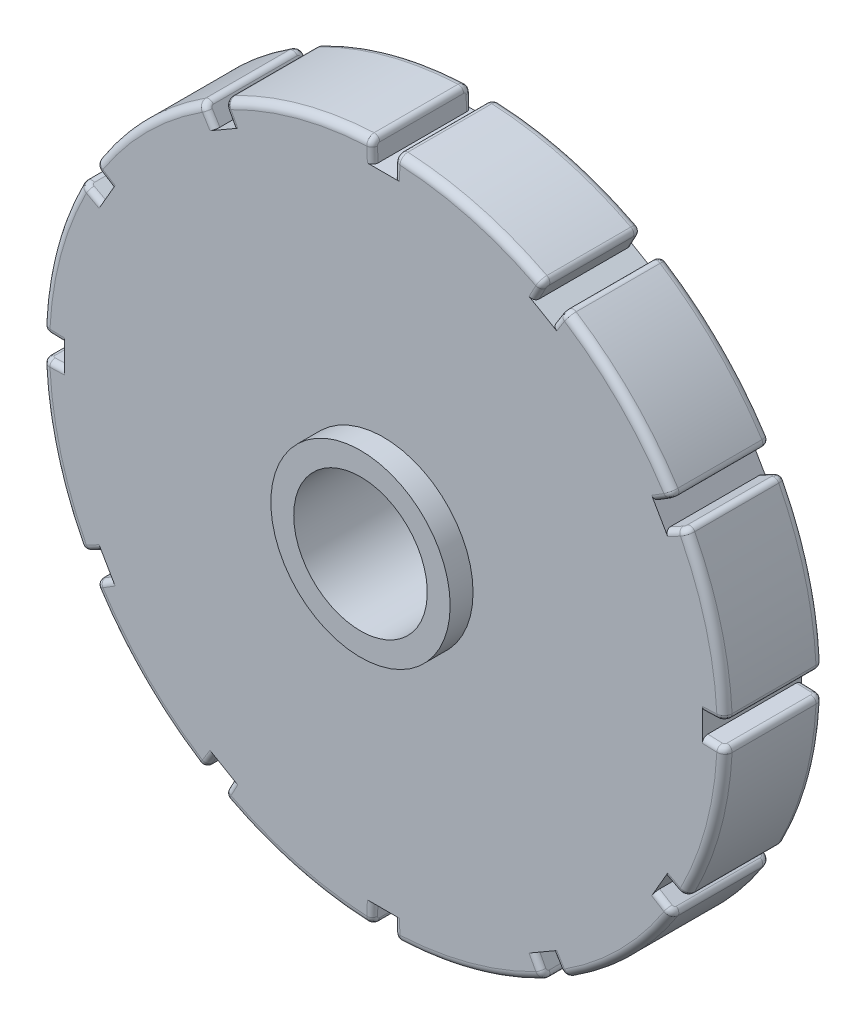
SolidWorks part; units mm, degrees
ref_plane "Face" through (0, 0, 0) normal (0, 0, 1) x (1, 0, 0)
ref_plane "Dessus" through (0, 0, 0) normal (0, 1, 0) x (1, 0, 0)
ref_plane "Droite" through (0, 0, 0) normal (1, 0, 0) x (0, 0, -1)
sketch "Esquisse1" plane through (0, 0, 0) normal (0, 0, 1) x (1, 0, 0)
  circle A0 centre (0, 0) radius 44.75
  circle A1 centre (0, 0) radius 8.75
  dimension "D1" = 89.5
  dimension "D2" = 17.5
extrude "Extrusion1" add sketch "Esquisse1" along normal blind 13
fillet "Congé1" radius 1
sketch "Esquisse2" plane through (0, 0, 13) normal (0, 0, 1) x (1, 0, 0)
  line L0 (0, 0) -> (0, 57.1861) construction
  line L1 (19.6909, 36.9101) -> (22.1197, 35.5078)
  line L2 (-1.4023, 41.8105) -> (1.4023, 41.8105)
  line L3 (23.6615, 37.9829) -> (22.1197, 35.5078)
  line L4 (1.5, 44.7249) -> (1.4023, 41.8105)
  line L5 (-1.5, 44.7249) -> (-1.4023, 41.8105)
  line L6 (21.0634, 39.4829) -> (19.6909, 36.9101)
  line L7 (35.5078, 22.1197) -> (36.9101, 19.6909)
  line L8 (39.4829, 21.0634) -> (36.9101, 19.6909)
  line L9 (37.9829, 23.6615) -> (35.5078, 22.1197)
  line L10 (41.8105, 1.4023) -> (41.8105, -1.4023)
  line L11 (44.7249, -1.5) -> (41.8105, -1.4023)
  line L12 (44.7249, 1.5) -> (41.8105, 1.4023)
  line L13 (36.9101, -19.6909) -> (35.5078, -22.1197)
  line L14 (37.9829, -23.6615) -> (35.5078, -22.1197)
  line L15 (39.4829, -21.0634) -> (36.9101, -19.6909)
  line L16 (22.1197, -35.5078) -> (19.6909, -36.9101)
  line L17 (21.0634, -39.4829) -> (19.6909, -36.9101)
  line L18 (23.6615, -37.9829) -> (22.1197, -35.5078)
  line L19 (1.4023, -41.8105) -> (-1.4023, -41.8105)
  line L20 (-1.5, -44.7249) -> (-1.4023, -41.8105)
  line L21 (1.5, -44.7249) -> (1.4023, -41.8105)
  line L22 (-19.6909, -36.9101) -> (-22.1197, -35.5078)
  line L23 (-23.6615, -37.9829) -> (-22.1197, -35.5078)
  line L24 (-21.0634, -39.4829) -> (-19.6909, -36.9101)
  line L25 (-35.5078, -22.1197) -> (-36.9101, -19.6909)
  line L26 (-39.4829, -21.0634) -> (-36.9101, -19.6909)
  line L27 (-37.9829, -23.6615) -> (-35.5078, -22.1197)
  line L28 (-41.8105, -1.4023) -> (-41.8105, 1.4023)
  line L29 (-44.7249, 1.5) -> (-41.8105, 1.4023)
  line L30 (-44.7249, -1.5) -> (-41.8105, -1.4023)
  line L31 (-36.9101, 19.6909) -> (-35.5078, 22.1197)
  line L32 (-37.9829, 23.6615) -> (-35.5078, 22.1197)
  line L33 (-39.4829, 21.0634) -> (-36.9101, 19.6909)
  line L34 (-22.1197, 35.5078) -> (-19.6909, 36.9101)
  line L35 (-21.0634, 39.4829) -> (-19.6909, 36.9101)
  line L36 (-23.6615, 37.9829) -> (-22.1197, 35.5078)
  circle A0 centre (0, 0) radius 44.75 construction
  arc A1 (-1.5, 44.7249) -> (1.5, 44.7249) centre (0, 43.6093) cw
  arc A2 (21.0634, 39.4829) -> (23.6615, 37.9829) centre (21.8046, 37.7667) cw
  arc A3 (37.9829, 23.6615) -> (39.4829, 21.0634) centre (37.7667, 21.8046) cw
  arc A4 (44.7249, 1.5) -> (44.7249, -1.5) centre (43.6093, 0) cw
  arc A5 (39.4829, -21.0634) -> (37.9829, -23.6615) centre (37.7667, -21.8046) cw
  arc A6 (23.6615, -37.9829) -> (21.0634, -39.4829) centre (21.8046, -37.7667) cw
  arc A7 (1.5, -44.7249) -> (-1.5, -44.7249) centre (0, -43.6093) cw
  arc A8 (-21.0634, -39.4829) -> (-23.6615, -37.9829) centre (-21.8046, -37.7667) cw
  arc A9 (-37.9829, -23.6615) -> (-39.4829, -21.0634) centre (-37.7667, -21.8046) cw
  arc A10 (-44.7249, -1.5) -> (-44.7249, 1.5) centre (-43.6093, 0) cw
  arc A11 (-39.4829, 21.0634) -> (-37.9829, 23.6615) centre (-37.7667, 21.8046) cw
  arc A12 (-23.6615, 37.9829) -> (-21.0634, 39.4829) centre (-21.8046, 37.7667) cw
  point P9 (0, 41.8105)
  point P16 (20.9053, 36.209)
  point P22 (36.209, 20.9053)
  point P28 (41.8105, 0)
  point P34 (36.209, -20.9053)
  point P40 (20.9053, -36.209)
  point P46 (0, -41.8105)
  point P52 (-20.9053, -36.209)
  point P58 (-36.209, -20.9053)
  point P64 (-41.8105, 0)
  point P70 (-36.209, 20.9053)
  point P76 (-20.9053, 36.209)
  dimension "D1" = 3
extrude "Enlèv. mat.-Extru.1" cut sketch "Esquisse2" against normal through all
fillet "Congé2" radius 0.7
sketch "Esquisse3" plane through (0, 0, 13) normal (0, 0, 1) x (1, 0, 0)
  circle A0 centre (0, 0) radius 11.75
  circle A1 centre (0, 0) radius 8.75 construction
  circle A2 centre (0, 0) radius 8.75
  dimension "D1" = 23.5
extrude "Extrusion2" add sketch "Esquisse3" along normal blind 3
